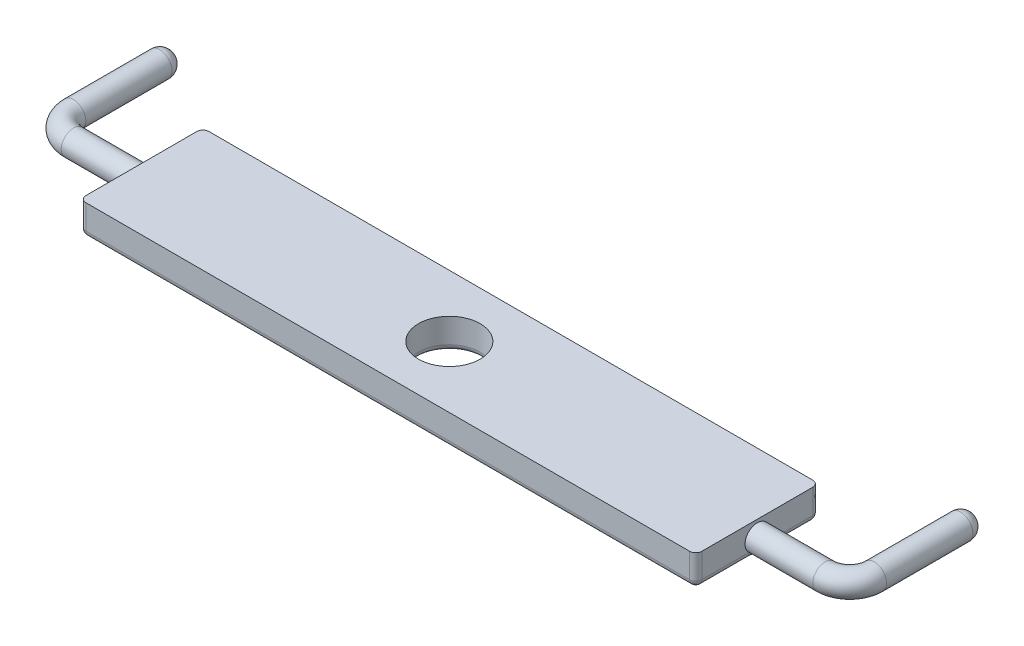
SolidWorks part; units mm, degrees
ref_plane "Front" through (0, 0, 0) normal (0, 0, 1) x (1, 0, 0)
ref_plane "Top" through (0, 0, 0) normal (0, 1, 0) x (1, 0, 0)
ref_plane "Right" through (0, 0, 0) normal (1, 0, 0) x (0, 0, -1)
sketch "Sketch1" plane through (0, 0, 0) normal (0, 1, 0) x (1, 0, 0)
  line L2 (25, 5) -> (-25, 5)
  line L3 (25, -5) -> (-25, -5)
  line L4 (-25, 5) -> (-25, -5)
  line L5 (25, 5) -> (25, -5)
  circle A2 centre (0, 0) radius 2.5
  dimension "D1" = 50
  dimension "D3" = 5
  dimension "D4" = 5
  dimension "D2" = 10
extrude "Extrude2" add sketch "Sketch1" along normal mid plane 2.5
sketch "Sketch2" plane through (0, 0, 0) normal (0, 1, 0) x (1, 0, 0)
  line L0 (25, 0) -> (30.5, 0)
  line L1 (25, -5) -> (25, 5) construction
  line L4 (32.5, 2) -> (32.5, 10)
  arc A0 (30.5, 0) -> (32.5, 2) centre (30.5, 2) ccw
  point P7 (32.5, 0)
  dimension "D2" = 2
  dimension "D1" = 7.5
  dimension "D3" = 10
sketch "Sketch3" plane through (0, 0, 0) normal (0, 1, 0) x (1, 0, 0)
  line L0 (-25, 0) -> (-30.5, 0)
  line L1 (-25, 5) -> (-25, -5) construction
  line L2 (-32.5, 2) -> (-32.5, 10)
  arc A0 (-30.5, 0) -> (-32.5, 2) centre (-30.5, 2) cw
  point P8 (-32.5, 0)
  dimension "D3" = 2
  dimension "D1" = 7.5
  dimension "D2" = 10
sketch "Sketch4" plane through (25, 0, 0) normal (1, 0, 0) x (0, 0, -1)
  circle A0 centre (0, 0) radius 1
sketch "Sketch5" plane through (-25, 0, 0) normal (-1, 0, 0) x (0, 0, 1)
  circle A0 centre (0, 0) radius 1
sweep "Sweep1" add profiles "Sketch4" path "Sketch2"
sweep "Sweep2" add profiles "Sketch5" path "Sketch3"
fillet "Fillet1" radius 0.5 5 edges at (0, -1.25, 2.5) (0, -1.25, -5) (-25, -1.25, 0) (0, -1.25, 5) (25, -1.25, 0)
fillet "Fillet2" radius 0.5 8 edges at (-24.8536, -1.1036, -4.8536) (24.8536, -1.1036, -4.8536) (-24.8536, -1.1036, 4.8536) (24.8536, -1.1036, 4.8536) (-25, 0.25, -5) (25, 0.25, -5) (-25, 0.25, 5) (25, 0.25, 5)
fillet "Fillet3" radius 1 2 edges at (-33.5, 0, -10) (31.5, 0, -10)
